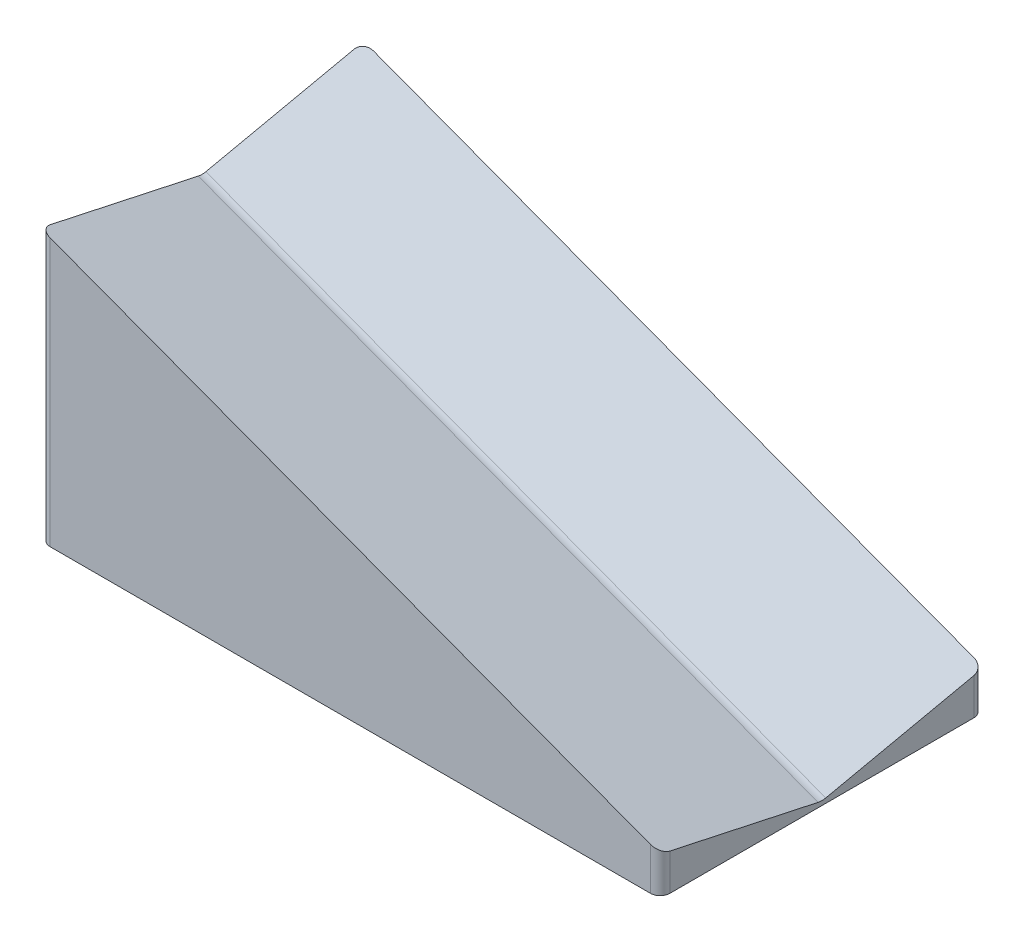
SolidWorks part; units mm, degrees
ref_plane "前视基准面" through (0, 0, 0) normal (0, 0, 1) x (1, 0, 0)
ref_plane "上视基准面" through (0, 0, 0) normal (0, 1, 0) x (1, 0, 0)
ref_plane "右视基准面" through (0, 0, 0) normal (1, 0, 0) x (0, 0, -1)
sketch "草图1" plane through (0, 0, 0) normal (0, 0, 1) x (1, 0, 0)
  line L0 (0, 70) -> (0, 0)
  line L1 (0, 0) -> (160, 0)
  line L2 (160, 0) -> (160, 10)
  line L3 (160, 10) -> (0, 70)
  dimension "D1" = 160
  dimension "D2" = 70
  dimension "D3" = 10
extrude "凸台-拉伸2" add sketch "草图1" along normal mid plane 83.5
sketch "草图2" plane through (160, 0, 0) normal (1, 0, 0) x (0, 0, -1)
  line L0 (0, 24.2128) -> (0, -12.3252) construction
  line L1 (41.75, 10) -> (0, 1)
  line L2 (0, 1) -> (-41.75, 10)
  line L3 (-41.75, 10) -> (41.75, 10)
  dimension "D1" = 1
sketch "草图3" plane through (0, 0, 0) normal (-1, 0, 0) x (0, 0, 1)
  line L0 (0, 72.1824) -> (0, -14.9342) construction
  line L1 (-41.75, 70) -> (0, 61)
  line L2 (0, 61) -> (41.75, 70)
  line L3 (41.75, 70) -> (-41.75, 70)
  dimension "D1" = 9
loft "切除-放样1" cut profiles "草图3", "草图2"
fillet "圆角1" radius 2.5 4 edges
fillet "圆角2" radius 5 1 edges
